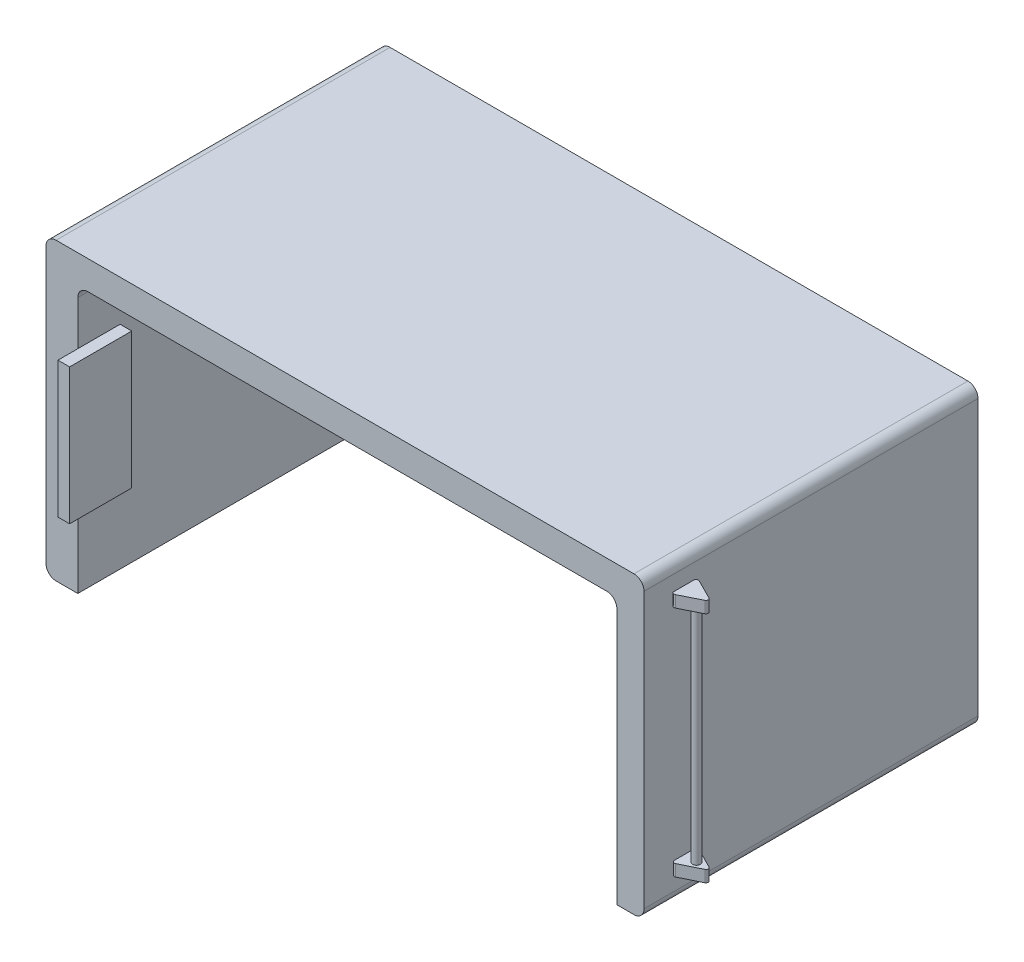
SolidWorks part; units mm, degrees
ref_plane "Front Plane" through (0, 0, 0) normal (0, 0, 1) x (1, 0, 0)
ref_plane "Top Plane" through (0, 0, 0) normal (0, 1, 0) x (1, 0, 0)
ref_plane "Right Plane" through (0, 0, 0) normal (1, 0, 0) x (0, 0, -1)
sketch "Sketch1" plane through (0, 0, 0) normal (0, 0, 1) x (1, 0, 0)
  line L0 (-744, -380) -> (-688.1292, -380)
  line L1 (-744, 380) -> (744, 380)
  line L2 (-770, 354) -> (-770, -354)
  line L4 (770, 354) -> (770, -354)
  line L5 (-770, 380) -> (770, -380) construction
  line L6 (-770, -380) -> (770, 380) construction
  line L7 (-688.1292, -380) -> (-688.1292, 280.1841)
  line L8 (-662.1292, 306.1841) -> (674, 306.1841)
  line L9 (700, 280.1841) -> (700, -380)
  line L10 (700, -380) -> (744, -380)
  arc A1 (744, -380) -> (770, -354) centre (744, -354) ccw
  arc A2 (674, 306.1841) -> (700, 280.1841) centre (674, 280.1841) cw
  arc A3 (744, 380) -> (770, 354) centre (744, 354) cw
  arc A4 (-744, 380) -> (-770, 354) centre (-744, 354) ccw
  arc A5 (-688.1292, 280.1841) -> (-662.1292, 306.1841) centre (-662.1292, 280.1841) cw
  arc A6 (-770, -354) -> (-744, -380) centre (-744, -354) ccw
  point P0 (0, 0)
  dimension "D3" = 70
  dimension "D1" = 1540
  dimension "D2" = 760
extrude "Boss-Extrude1" add sketch "Sketch1" along normal blind 860
sketch "Sketch6" plane through (0, 0, 0) normal (0, 0, -1) x (-1, 0, 0)
  line L1 (-744, 380) -> (744, 380)
  line L2 (-770, 354) -> (-770, -354)
  line L3 (-744, -380) -> (744, -380)
  line L4 (770, 354) -> (770, -354)
  line L5 (-770, 380) -> (770, -380) construction
  line L6 (-770, -380) -> (770, 380) construction
  arc A0 (744, -380) -> (770, -354) centre (744, -354) ccw
  arc A1 (-770, -354) -> (-744, -380) centre (-744, -354) ccw
  arc A2 (-744, 380) -> (-770, 354) centre (-744, 354) ccw
  arc A3 (744, 380) -> (770, 354) centre (744, 354) cw
  point P0 (0, 0)
  dimension "D1" = 26
  dimension "D2" = 708
  dimension "D3" = 1488
extrude "Boss-Extrude4" add sketch "Sketch6" against normal blind 40
ref_plane "Plane2" through (0, -300, 0) normal (0, 1, 0) x (1, 0, 0)
sketch "Sketch7" plane through (0, -300, 0) normal (0, 1, 0) x (1, 0, 0)
  line L0 (770, -782.2688) -> (770, -731.6856)
  line L1 (778.7253, -726.3403) -> (829.3085, -752.1304)
  line L2 (829.2239, -762.8634) -> (778.6407, -787.6565)
  line L3 (770, -860) -> (770, 0) construction
  arc A0 (829.3085, -752.1304) -> (829.2239, -762.8634) centre (826.5832, -757.4757) cw
  arc A1 (770, -731.6856) -> (778.7253, -726.3403) centre (776, -731.6856) cw
  arc A2 (770, -782.2688) -> (778.6407, -787.6565) centre (776, -782.2688) ccw
  point P5 (840, -757.5815)
  point P8 (770, -721.8917)
  point P11 (770, -791.8917)
  point P12 (770, -756.9772)
  dimension "D3" = 6
  dimension "D1" = 70
  dimension "D2" = 70
extrude "Boss-Extrude5" add sketch "Sketch7" along normal mid plane 30 separate body
ref_plane "Plane3" through (0, 300, 0) normal (0, 1, 0) x (1, 0, 0)
sketch "Sketch10" plane through (0, 300, 0) normal (0, 1, 0) x (1, 0, 0)
  line L0 (770, -732.0673) -> (770, -782.6509)
  line L1 (770, -860) -> (770, 0) construction
  line L2 (778.6762, -788.021) -> (829.2598, -762.8123)
  line L3 (829.2739, -752.0792) -> (778.6903, -726.7043)
  arc A0 (829.2598, -762.8123) -> (829.2739, -752.0792) centre (826.5836, -757.4422) ccw
  arc A1 (770, -782.6509) -> (778.6762, -788.021) centre (776, -782.6509) ccw
  arc A2 (770, -732.0673) -> (778.6903, -726.7043) centre (776, -732.0673) cw
  point P7 (840, -757.4599)
  point P10 (770, -792.3449)
  point P13 (770, -722.3449)
  dimension "D3" = 6
  dimension "D1" = 70
  dimension "D2" = 70
extrude "Boss-Extrude6" add sketch "Sketch10" along normal mid plane 30
sketch "Sketch11" plane through (0, 285, 0) normal (0, -1, 0) x (1, 0, 0)
  circle A0 centre (802.583, 757.4757) radius 10
  arc A1 (829.3085, 752.1304) -> (829.2239, 762.8634) centre (826.5832, 757.4757) ccw construction
  point P5 (832.583, 757.523)
  dimension "D1" = 20
  dimension "D2" = 30
extrude "Boss-Extrude7" add sketch "Sketch11" along normal blind 570
sketch "Sketch12" plane through (0, -380, 0) normal (0, -1, 0) x (1, 0, 0)
  line L0 (-744, 860) -> (-744, 0) construction
  line L1 (-744, 860) -> (-688.1292, 860) construction
  line L3 (-688.1292, 860) -> (-688.1292, 40) construction
  line L4 (-744, 0) -> (744, 0) construction
  circle A0 centre (-708, 693) radius 5
  circle A1 centre (-708, 603) radius 5
  circle A2 centre (-708.1292, 158) radius 5
  circle A3 centre (-708.1292, 248) radius 5
  dimension "D1" = 36
  dimension "D2" = 167
  dimension "D3" = 10
  dimension "D4" = 36
  dimension "D5" = 90
  dimension "D6" = 10
  dimension "D7" = 90
  dimension "D8" = 20
  dimension "D9" = 158
extrude "Cut-Extrude1" cut sketch "Sketch12" against normal blind 20
sketch "Sketch14" plane through (-688.1292, 0, 0) normal (1, 0, 0) x (0, 0, -1)
  line L1 (-751.0599, -184.044) -> (-911.0599, -184.044)
  line L2 (-751.0599, -184.044) -> (-751.0599, 165.956)
  line L3 (-751.0599, 165.956) -> (-911.0599, 165.956)
  line L4 (-911.0599, -184.044) -> (-911.0599, 165.956)
  dimension "D1" = 350
  dimension "D2" = 160
extrude "Boss-Extrude8" [suppressed] add sketch "Sketch14" along normal blind 30
